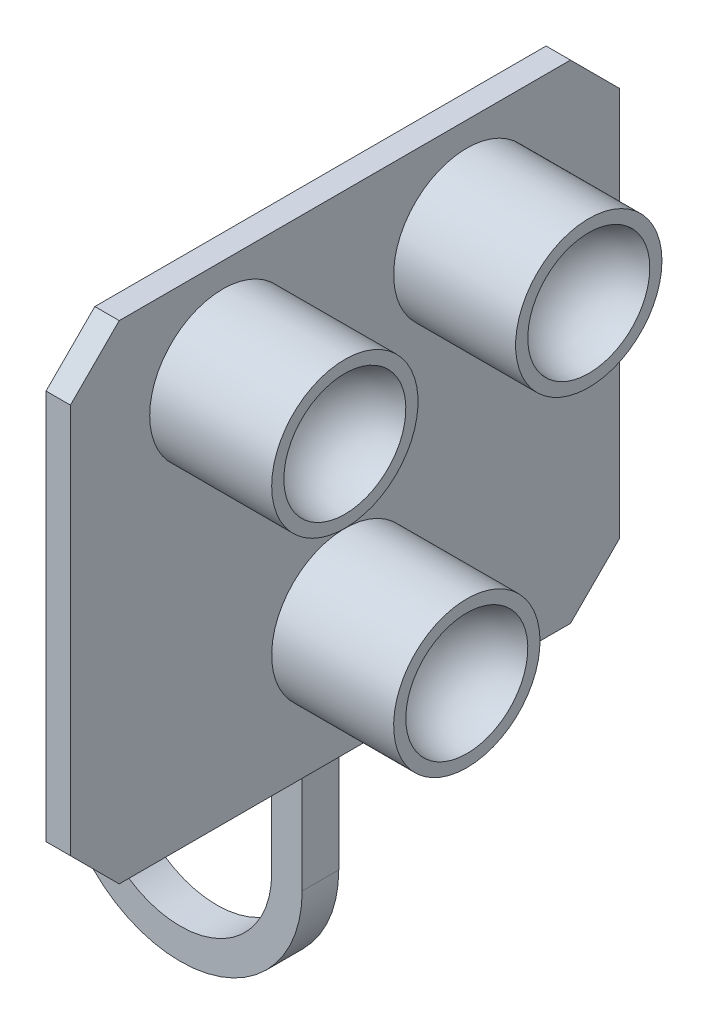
SolidWorks part; units mm, degrees
ref_plane "Front" through (0, 0, 0) normal (0, 0, 1) x (1, 0, 0)
ref_plane "Top" through (0, 0, 0) normal (0, 1, 0) x (1, 0, 0)
ref_plane "Right" through (0, 0, 0) normal (1, 0, 0) x (0, 0, -1)
sketch "Sketch1" plane through (0, 0, 0) normal (1, 0, 0) x (0, 0, -1)
  line L1 (-225, 400) -> (225, 400)
  line L2 (-225, 400) -> (-225, 0)
  line L3 (-225, 0) -> (225, 0)
  line L4 (225, 400) -> (225, 0)
  dimension "D1" = 450
  dimension "D2" = 400
extrude "Boss-Extrude1" add sketch "Sketch1" against normal blind 20
sketch "Sketch2" plane through (0, 0, 0) normal (0, 0, 1) x (1, 0, 0)
  line L0 (0, 100) -> (100, 100) construction
  line L1 (0, 400) -> (0, 0) construction
  line L2 (0, 40) -> (100, 40)
  line L3 (50, 100) -> (0, 100)
  line L4 (0, 100) -> (0, 40)
  line L5 (100, 50) -> (100, 40)
  arc A0 (50, 100) -> (100, 50) centre (100, 100) ccw
  dimension "D1" = 50
  dimension "D2" = 120
  dimension "D3" = 100
  dimension "D4" = 100
revolve "Revolve1" add sketch "Sketch2" angle 360 about L0
ref_plane "Plane1" through (0, 0, 100) normal (0, 0, 1) x (1, 0, 0)
sketch "Sketch4" plane through (0, 0, 100) normal (0, 0, 1) x (1, 0, 0)
  line L0 (0, 320) -> (100, 320) construction
  line L2 (0, 260) -> (100, 260)
  line L3 (50, 320) -> (0, 320)
  line L4 (0, 320) -> (0, 260)
  line L5 (100, 270) -> (100, 260)
  line L6 (0, 400) -> (0, 0) construction
  arc A0 (50, 320) -> (100, 270) centre (100, 320) ccw
  dimension "D1" = 50
  dimension "D2" = 120
  dimension "D3" = 100
  dimension "D4" = 320
revolve "Revolve2" add sketch "Sketch4" angle 360 about L0
mirror "Mirror1" about plane through (0, 0, 0) normal (0, 0, 1) of "Revolve2"
chamfer "Chamfer1" distance 40 angle 45 4 edges at (-10, 0, 225) (-10, 400, 225) (-10, 0, -225) (-10, 400, -225)
sketch "Sketch5" plane through (0, 0, 0) normal (0, 0, 1) x (1, 0, 0)
  line L0 (-20, 360) -> (-20, -100)
  line L1 (-20, 360) -> (-20, 40) construction
  line L2 (0, 0) -> (-20, 0) construction
  line L3 (-45, 360) -> (-45, -100)
  arc A0 (-20, -100) -> (-220, -100) centre (-120, -100) cw
  arc A1 (-45, -100) -> (-195, -100) centre (-120, -100) cw
  arc A2 (-20, 360) -> (-45, 360) centre (-32.5, 360) ccw
  arc A3 (-220, -100) -> (-195, -100) centre (-207.5, -100) cw
  dimension "D1" = 100
  dimension "D2" = 100
  dimension "D3" = 25
extrude "Boss-Extrude2" add sketch "Sketch5" along normal mid plane 30
fillet "Fillet1" radius 15 2 edges at (-20, 180, -15) (-20, 180, 15)
